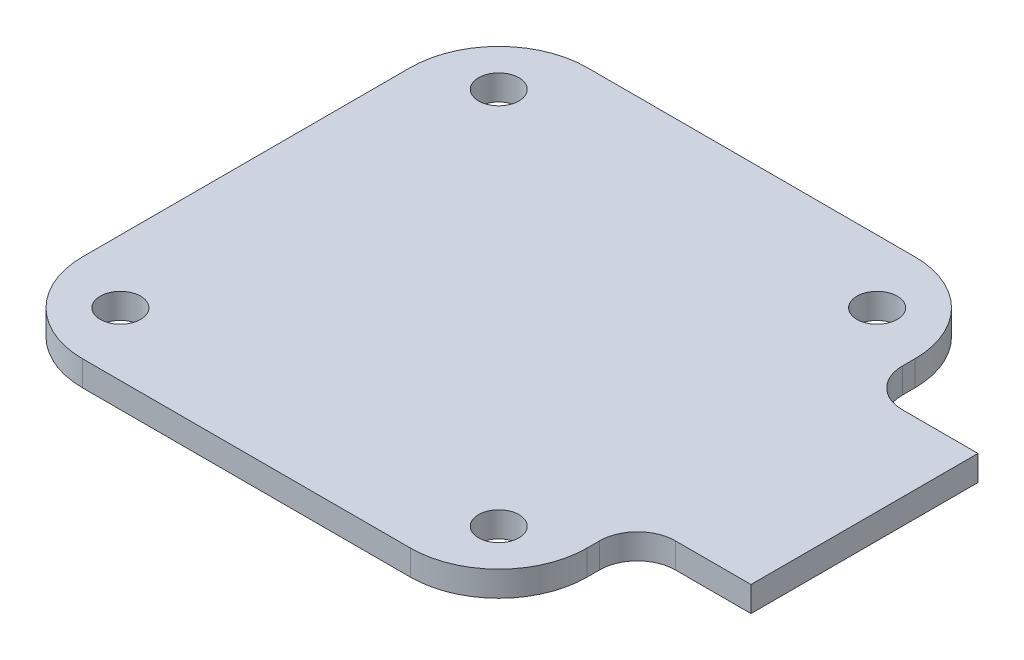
SolidWorks part; units mm, degrees
ref_plane "前视基准面" through (0, 0, 0) normal (0, 0, 1) x (1, 0, 0)
ref_plane "上视基准面" through (0, 0, 0) normal (0, 1, 0) x (1, 0, 0)
ref_plane "右视基准面" through (0, 0, 0) normal (1, 0, 0) x (0, 0, -1)
sketch "草图1" plane through (0, 0, 0) normal (0, 1, 0) x (1, 0, 0)
  line L0 (-17.3708, 19.6206) -> (8.6292, 19.6206)
  line L1 (-24.3708, 12.6206) -> (-24.3708, -13.3794)
  line L2 (-17.3708, -20.3794) -> (8.6292, -20.3794)
  line L3 (15.6292, -13.3794) -> (15.6292, -12.3794)
  line L4 (18.6292, -9.3794) -> (24.6292, -9.3794)
  line L5 (24.6292, -9.3794) -> (24.6292, 8.6206)
  line L6 (24.6292, 8.6206) -> (18.6292, 8.6206)
  line L7 (15.6292, 11.6206) -> (15.6292, 12.6206)
  arc A0 (-17.3708, 19.6206) -> (-24.3708, 12.6206) centre (-17.3708, 12.6206) ccw
  arc A1 (-24.3708, -13.3794) -> (-17.3708, -20.3794) centre (-17.3708, -13.3794) ccw
  arc A2 (15.6292, 12.6206) -> (8.6292, 19.6206) centre (8.6292, 12.6206) ccw
  arc A3 (15.6292, -13.3794) -> (8.6292, -20.3794) centre (8.6292, -13.3794) cw
  arc A4 (15.6292, 11.6206) -> (18.6292, 8.6206) centre (18.6292, 11.6206) ccw
  arc A5 (15.6292, -12.3794) -> (18.6292, -9.3794) centre (18.6292, -12.3794) cw
  point P10 (-24.3708, 19.6206)
  point P13 (-24.3708, -20.3794)
  point P16 (15.6292, 19.6206)
  point P19 (15.6292, -20.3794)
  point P22 (15.6292, 8.6206)
  dimension "D7" = 7
  dimension "D8" = 7
  dimension "D9" = 7
  dimension "D10" = 7
  dimension "D11" = 3
  dimension "D12" = 3
  dimension "D1" = 40
  dimension "D2" = 40
  dimension "D3" = 18
  dimension "D4" = 40
  dimension "D5" = 49
  dimension "D6" = 11
extrude "凸台-拉伸1" add sketch "草图1" along normal blind 2
sketch "草图2" plane through (0, 0, 0) normal (0, -1, 0) x (1, 0, 0)
  line L0 (-4.3708, -19.6206) -> (-4.3708, 71.4249) construction
  line L1 (8.6292, -19.6206) -> (-17.3708, -19.6206) construction
  line L2 (-24.3708, 0.3794) -> (28.7588, 0.3794) construction
  line L3 (-24.3708, -12.6206) -> (-24.3708, 13.3794) construction
  circle A1 centre (-19.3708, 15.3794) radius 1.6
  circle A2 centre (10.6292, -14.6206) radius 1.6
  circle A3 centre (10.6292, 15.3794) radius 1.6
  circle A4 centre (-19.3708, -14.6206) radius 1.6
  dimension "D1" = 15
  dimension "D3" = 15
  dimension "D4" = 15
  dimension "D5" = 15
  dimension "D6" = 15
  dimension "D7" = 15
extrude "切除-拉伸1" cut sketch "草图2" against normal blind 10
